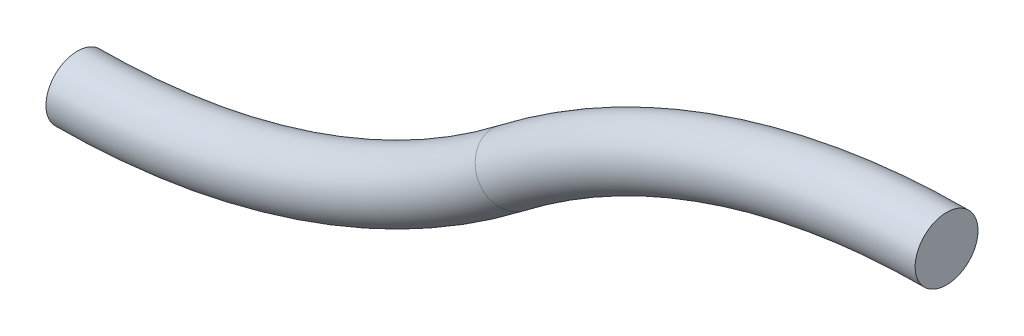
SolidWorks part; units mm, degrees
ref_plane "Front Plane" through (0, 0, 0) normal (0, 0, 1) x (1, 0, 0)
ref_plane "Top Plane" through (0, 0, 0) normal (0, 1, 0) x (1, 0, 0)
ref_plane "Right Plane" through (0, 0, 0) normal (1, 0, 0) x (0, 0, -1)
sketch "Sketch1" plane through (0, 0, 0) normal (0, 0, 1) x (1, 0, 0)
  line L0 (109.7026, 37.2189) -> (142.6855, 37.2189) construction
  line L1 (0, 0) -> (-52.2095, 0) construction
  arc A0 (0, 0) -> (54.8513, 18.6094) centre (0, 90.1418) ccw
  arc A1 (54.8513, 18.6094) -> (109.7026, 37.2189) centre (109.7026, -52.9229) cw
  point P0 (0, 0)
  point P1 (109.7026, 37.2189)
  dimension "D1" = 115.8443
  dimension "D2" = 109.7026
sketch "Sketch2" plane through (0, 0, 0) normal (1, 0, 0) x (0, 0, -1)
  circle A0 centre (0, 0) radius 3.9688
  dimension "D1" = 7.9375
sweep "Sweep1" add profiles "Sketch2" path "Sketch1"
